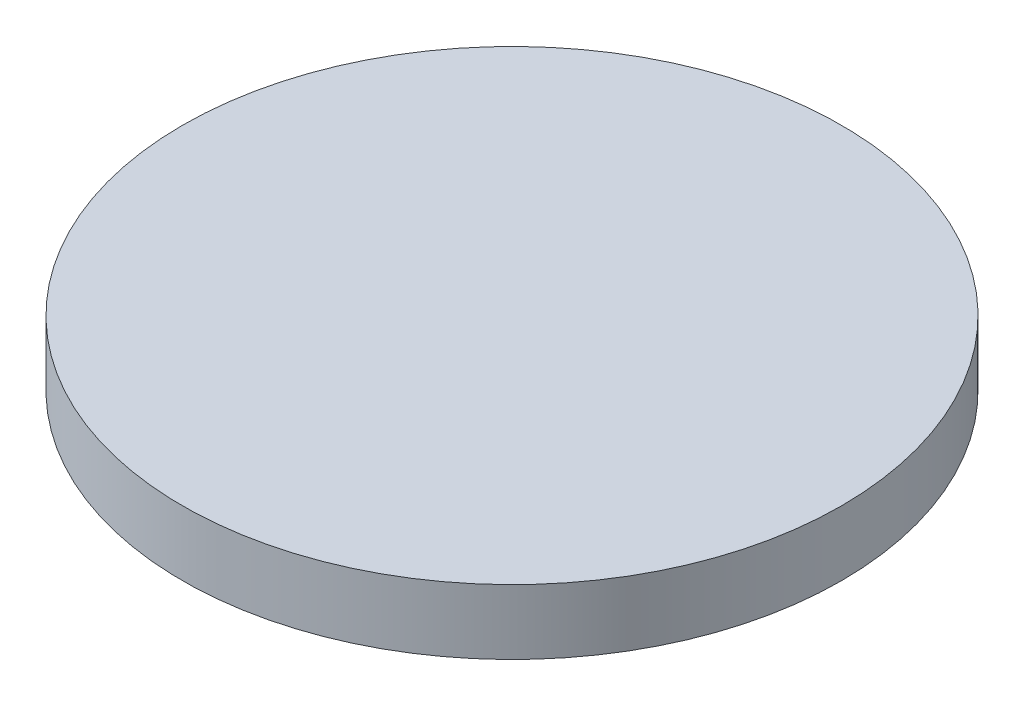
SolidWorks part; units mm, degrees
ref_plane "前视基准面" through (0, 0, 0) normal (0, 0, 1) x (1, 0, 0)
ref_plane "上视基准面" through (0, 0, 0) normal (0, 1, 0) x (1, 0, 0)
ref_plane "右视基准面" through (0, 0, 0) normal (1, 0, 0) x (0, 0, -1)
other "Configuration Table"
sketch "草图1" plane through (0, 0, 0) normal (0, 0, 1) x (1, 0, 0)
  line L0 (25.4, 1.7918) -> (25.4, 6.7918)
  line L1 (25.4, 6.7918) -> (0, 6.7918)
  line L2 (0, 6.7918) -> (0, 0)
  spline S0 degree 4 poles (-2.5491, 0.0236) (-2.4949, 0.0229) (-2.3987, 0.0214) (-2.3127, 0.0187) (-1.8561, 0.0136) (-1.5128, 0.0058) (-0.3076, -0.0003) (0.1539, -0.0011) (1.4838, 0.0056) (2.2225, 0.0179) (3.243, 0.0363) (4.0946, 0.0606) (5.0477, 0.0907) (5.9394, 0.1265) (6.8672, 0.1676) (7.7742, 0.2143) (8.6908, 0.2656) (9.6054, 0.3223) (10.5139, 0.3824) (11.4363, 0.4486) (12.522, 0.5302) (13.8871, 0.6416) (15.381, 0.7699) (17.2659, 0.9466) (18.9357, 1.1085) (20.9983, 1.3208) (22.4246, 1.4694) (24.7021, 1.7155) (25.5762, 1.8108) (26.6461, 1.9284) (27.4722, 2.0195) (27.6019, 2.0342) (27.8635, 2.063) (27.9185, 2.0692) knots 0 0 0 0 0 0.005229 0.010457 0.020914 0.041829 0.083157 0.113122 0.143087 0.173053 0.203018 0.232984 0.262949 0.292914 0.32288 0.352845 0.382811 0.412776 0.442741 0.472707 0.502672 0.557597 0.617528 0.677458 0.737389 0.79732 0.857251 0.917182 0.958591 0.979295 0.989648 1 1 1 1 1 construction
  spline S1 degree 4 poles (0, 0) (0.1909, 0) (0.5728, 0.001) (1.4838, 0.0056) (2.2225, 0.0179) (3.243, 0.0363) (4.0946, 0.0606) (5.0477, 0.0907) (5.9394, 0.1265) (6.8672, 0.1676) (7.7742, 0.2143) (8.6908, 0.2656) (9.6054, 0.3223) (10.5139, 0.3824) (11.4363, 0.4486) (12.522, 0.5302) (13.8871, 0.6416) (15.381, 0.7699) (17.2659, 0.9466) (18.9357, 1.1085) (20.9983, 1.3208) (22.4246, 1.4694) (24.2757, 1.6694) (25.0205, 1.7503) (25.4, 1.7918) knots 0.083157 0.083157 0.083157 0.083157 0.083157 0.113122 0.143087 0.173053 0.203018 0.232984 0.262949 0.292914 0.32288 0.352845 0.382811 0.412776 0.442741 0.472707 0.502672 0.557597 0.617528 0.677458 0.737389 0.79732 0.857251 0.917182 0.917182 0.917182 0.917182 0.917182
  dimension "D1" = 5
revolve "旋转1" add sketch "草图1" angle 360 about L2
